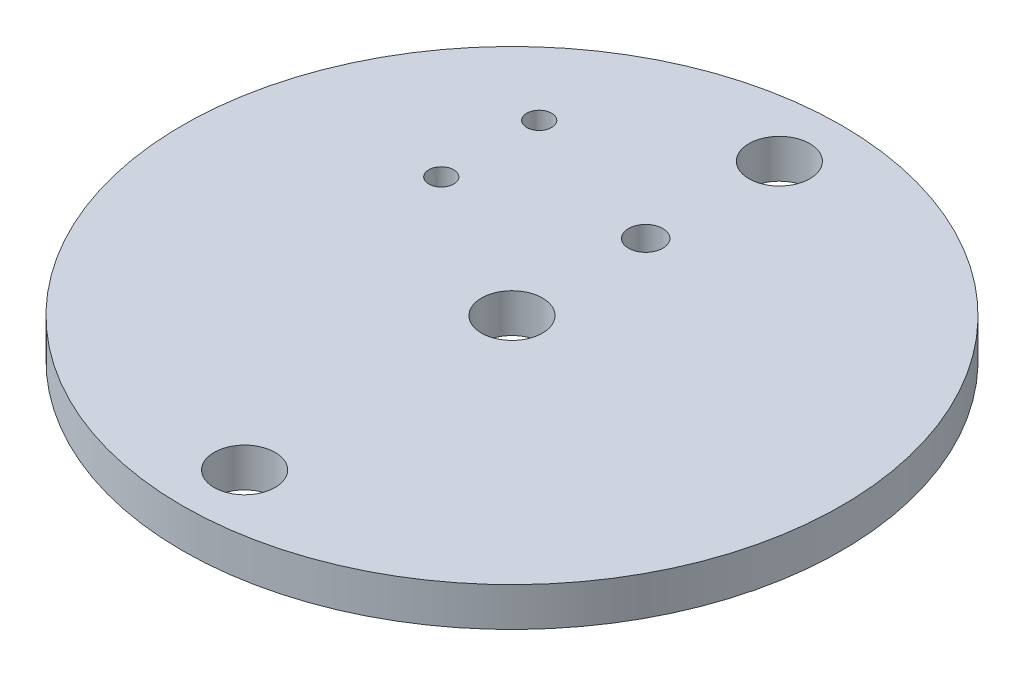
SolidWorks part; units mm, degrees
ref_plane "Front Plane" through (0, 0, 0) normal (0, 0, 1) x (1, 0, 0)
ref_plane "Top Plane" through (0, 0, 0) normal (0, 1, 0) x (1, 0, 0)
ref_plane "Right Plane" through (0, 0, 0) normal (1, 0, 0) x (0, 0, -1)
sketch "Sketch1" plane through (0, 0, 0) normal (0, 1, 0) x (1, 0, 0)
  circle A0 centre (0, 0) radius 26.924
  dimension "D1" = 53.848
extrude "Boss-Extrude1" add sketch "Sketch1" along normal blind 3.175
hole_wizard "#10 Clearance Hole1" positions "Sketch3" profile "Sketch4" hole size "#10" standard "ANSI Inch"
sketch "Sketch3" plane through (0, 3.175, 0) normal (0, 1, 0) x (1, 0, 0)
  line L0 (-26.924, 0) -> (26.924, 0) construction
  line L2 (0, 26.924) -> (0, -26.924) construction
  circle A0 centre (0, 0) radius 26.924 construction
  point P0 (0, 0)
  point P21 (0, -21.844)
  point P23 (0, 21.844)
  dimension "D1" = 21.844
  dimension "D2" = 21.844
sketch "Sketch4" plane through (0, 3.175, 0) normal (1, 0, 0) x (0, 0, 1)
  line L0 (0, 0) -> (0, 3.175)
  line L1 (0, 3.175) -> (2.4892, 3.175)
  line L2 (2.4892, 3.175) -> (2.4892, 0)
  line L5 (2.4892, 0) -> (0, 0)
  line L11 (0, -6.35) -> (0, 107.95) construction
  dimension "Thru Hole Dia." = 4.9784
  dimension "Thru Hole Depth" = 3.175
sketch "Sketch5" plane through (0, 3.175, 0) normal (0, 1, 0) x (1, 0, 0)
  line L0 (0, 21.844) -> (0, 0) construction
  line L1 (0, 10.922) -> (-19.0071, 10.922) construction
  line L2 (-7.747, 17.7165) -> (7.747, 17.7165) construction
  line L3 (-7.747, 17.7165) -> (-7.747, 4.1275) construction
  line L4 (-7.747, 4.1275) -> (7.747, 4.1275) construction
  line L5 (7.747, 17.7165) -> (7.747, 4.1275) construction
  line L6 (-7.747, 17.7165) -> (7.747, 4.1275) construction
  line L7 (-7.747, 4.1275) -> (7.747, 17.7165) construction
  line L8 (-12.7, 17.7165) -> (-12.7, 4.1275) construction
  circle A0 centre (0, 10.922) radius 1.4
  circle A1 centre (-12.7, 14.922) radius 1.016
  circle A2 centre (-12.7, 6.922) radius 1.016
  point P4 (0, 10.922)
  dimension "D1" = 13.589
  dimension "D4" = 2.8
  dimension "D5" = 4
  dimension "D7" = 2.032
  dimension "D8" = 2.032
  dimension "D2" = 15.494
  dimension "D3" = 12.7
  dimension "D6" = 4
extrude "Cut-Extrude1" cut sketch "Sketch5" against normal through all
sketch "Sketch6" plane through (0, 3.175, 0) normal (0, 1, 0) x (1, 0, 0)
  circle A2 centre (0, 0) radius 27.0256
  circle A3 centre (0, 0) radius 27.0256
  circle A5 centre (0, 21.844) radius 2.3876
  circle A6 centre (0, 21.844) radius 2.3876
  circle A8 centre (-12.7, 14.922) radius 0.9144
  circle A9 centre (-12.7, 14.922) radius 0.9144
  circle A12 centre (-12.7, 6.922) radius 0.9144
  circle A13 centre (-12.7, 6.922) radius 0.9144
  circle A15 centre (0, 10.922) radius 1.2984
  circle A16 centre (0, 10.922) radius 1.2984
  circle A18 centre (0, 0) radius 2.3876
  circle A19 centre (0, 0) radius 2.3876
  circle A21 centre (0, -21.844) radius 2.3876
  circle A22 centre (0, -21.844) radius 2.3876
equation "\"t\" = .125in"
equation "\"kerf\"= .004in"
equation "\"D1@Boss-Extrude1\"=\"t\""
equation "\"D1@Sketch6\"=\"kerf\""
equation "\"D8@Sketch6\"=\"kerf\""
equation "\"D7@Sketch6\"=\"kerf\""
equation "\"D5@Sketch6\"=\"kerf\""
equation "\"D6@Sketch6\"=\"kerf\""
equation "\"D3@Sketch6\"=\"kerf\""
equation "\"D2@Sketch6\"=\"kerf\""
